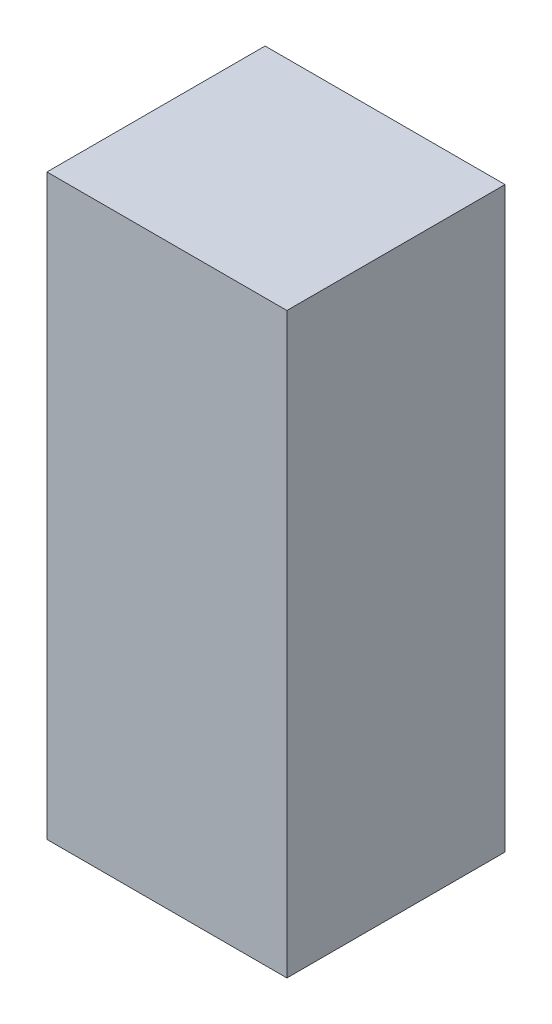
SolidWorks part; units mm, degrees
ref_plane "Plan de face" through (0, 0, 0) normal (0, 0, 1) x (1, 0, 0)
ref_plane "Plan de dessus" through (0, 0, 0) normal (0, 1, 0) x (1, 0, 0)
ref_plane "Plan de droite" through (0, 0, 0) normal (1, 0, 0) x (0, 0, -1)
sketch "Esquisse1" plane through (0, 0, 0) normal (0, 0, 1) x (1, 0, 0)
  line L8 (43.1465, -55.4213) -> (40.9465, -55.4213)
  line L9 (40.9465, -55.4213) -> (40.9465, -60.7213)
  line L10 (40.9465, -60.7213) -> (43.1465, -60.7213)
  line L11 (43.1465, -60.7213) -> (43.1465, -55.4213)
  line L12 (43.1465, -55.4213) -> (40.9465, -55.4213)
  line L13 (40.9465, -55.4213) -> (40.9465, -60.7213)
  line L14 (40.9465, -60.7213) -> (43.1465, -60.7213)
  line L15 (43.1465, -60.7213) -> (43.1465, -55.4213)
  dimension "D1" = 0.5
extrude "Extrusion1" add sketch "Esquisse1" along normal blind 2
